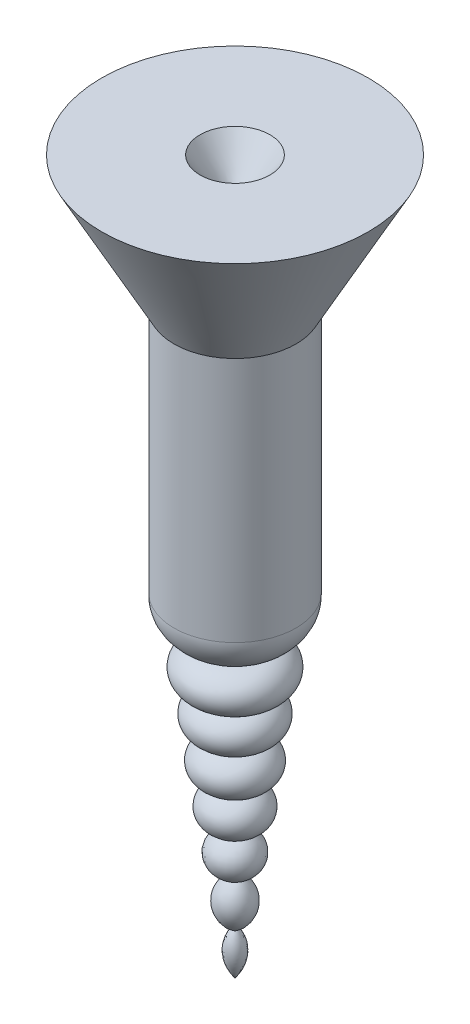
SolidWorks part; units mm, degrees
ref_plane "Front Plane" through (0, 0, 0) normal (0, 0, 1) x (1, 0, 0)
ref_plane "Top Plane" through (0, 0, 0) normal (0, 1, 0) x (1, 0, 0)
ref_plane "Right Plane" through (0, 0, 0) normal (1, 0, 0) x (0, 0, -1)
sketch "Sketch1" plane through (0, 0, 0) normal (0, 0, 1) x (1, 0, 0)
  line L9 (0.6238, 0.8752) -> (0, 0)
  line L10 (1.09, -1.5057) -> (2.3812, 0.8752)
  line L11 (2.3812, 0.8752) -> (0.6238, 0.8752)
  line L12 (1.09, -1.5057) -> (1.09, -5.8999)
  line L13 (0, 0) -> (0, -11.8575)
  ellipse E16 centre (0.0615, -9.1982) end of major axis (-0.4093, -9.1982) minor radius 0.3766 (0.1676, -9.5652) -> (0.2538, -8.8544) ccw
  ellipse E17 centre (-0.073, -9.9075) end of major axis (0.4179, -9.9075) minor radius 0.3928 (0.1126, -10.2711) -> (0.1676, -9.5652) ccw
  ellipse E18 centre (0.1782, -8.4908) end of major axis (-0.2825, -8.4908) minor radius 0.3686 (0.2538, -8.8544) -> (0.2781, -8.1311) ccw
  ellipse E19 centre (0.3887, -7.0438) end of major axis (0.8586, -7.0438) minor radius 0.3759 (0.4112, -7.4192) -> (0.3356, -6.6703) ccw
  ellipse E20 centre (0.2662, -7.7657) end of major axis (0.723, -7.7657) minor radius 0.3655 (0.2781, -8.1311) -> (0.4112, -7.4192) ccw
  ellipse E21 centre (0.1423, -5.9277) end of major axis (1.0906, -5.9277) minor radius 0.7586 (0.3356, -6.6703) -> (1.09, -5.8999) ccw
  ellipse E22 centre (-2.0546, -11.5654) end of major axis (0.1609, -11.3755) minor radius 1.1214 (0, -11.8575) -> (0.0572, -11.0875) ccw
  ellipse E23 centre (-0.3932, -10.6585) end of major axis (-1.0935, -10.6585) minor radius 0.5602 (0.0572, -11.0875) -> (0.1126, -10.2711) ccw
revolve "Revolve3" add sketch "Sketch1" angle 360 about L13
